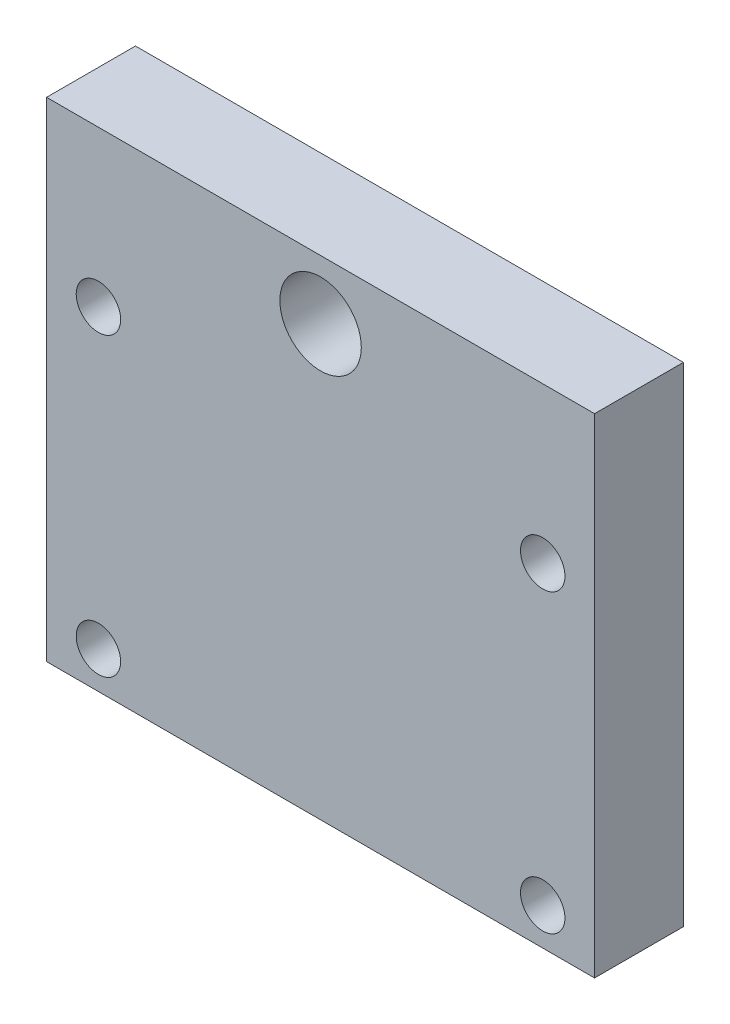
SolidWorks part; units mm, degrees
ref_plane "Plan de face" through (0, 0, 0) normal (0, 0, 1) x (1, 0, 0)
ref_plane "Plan de dessus" through (0, 0, 0) normal (0, 1, 0) x (1, 0, 0)
ref_plane "Plan de droite" through (0, 0, 0) normal (1, 0, 0) x (0, 0, -1)
sketch "Esquisse1" plane through (0, 0, 0) normal (0, 0, 1) x (1, 0, 0)
  line L0 (-5.2892, 12.5) -> (36.046, 12.5) construction
  line L1 (0, 0) -> (37, 0)
  line L2 (0, 0) -> (0, 25)
  line L3 (0, 25) -> (37, 25)
  line L4 (37, 0) -> (37, 25)
  line L5 (18.5, 25) -> (18.5, 0) construction
  line L6 (0, -5.0786) -> (0, 29.9463) construction
  line L7 (-2.6889, 0) -> (40.8799, 0) construction
  line L8 (2.5, -3.858) -> (2.5, 4.5267) construction
  line L9 (11.8517, 2.5) -> (1.0259, 2.5) construction
  line L10 (33, 26.8823) -> (33, 6.9907) construction
  circle A0 centre (3.5, 2.5) radius 1.5
  circle A1 centre (33.5, 2.5) radius 1.5
  circle A2 centre (33.5, 22.5) radius 1.5
  circle A3 centre (3.5, 22.5) radius 1.5
  dimension "D5" = 4
  dimension "D1" = 12.5
  dimension "D2" = 30
  dimension "D3" = 37
extrude "Extrusion1" add sketch "Esquisse1" along normal blind 6
sketch "Esquisse2" plane through (0, 25, 0) normal (0, 1, 0) x (-1, 0, 0)
  line L1 (0, 0) -> (-37, 0)
  line L2 (0, 0) -> (0, 6)
  line L3 (0, 6) -> (-37, 6)
  line L4 (-37, 0) -> (-37, 6)
extrude "Extrusion2" add sketch "Esquisse2" along normal blind 8
sketch "Esquisse3" plane through (0, 0, 6) normal (0, 0, 1) x (1, 0, 0)
  line L0 (18.5, 33) -> (18.5, 0) construction
  line L1 (0, 33) -> (37, 33) construction
  line L2 (0, 0) -> (37, 0) construction
  circle A0 centre (18.5, 29) radius 2.75
  dimension "D1" = 5.5
  dimension "D2" = 4
extrude "Enlèv. mat.-Extru.1" cut sketch "Esquisse3" against normal through all
